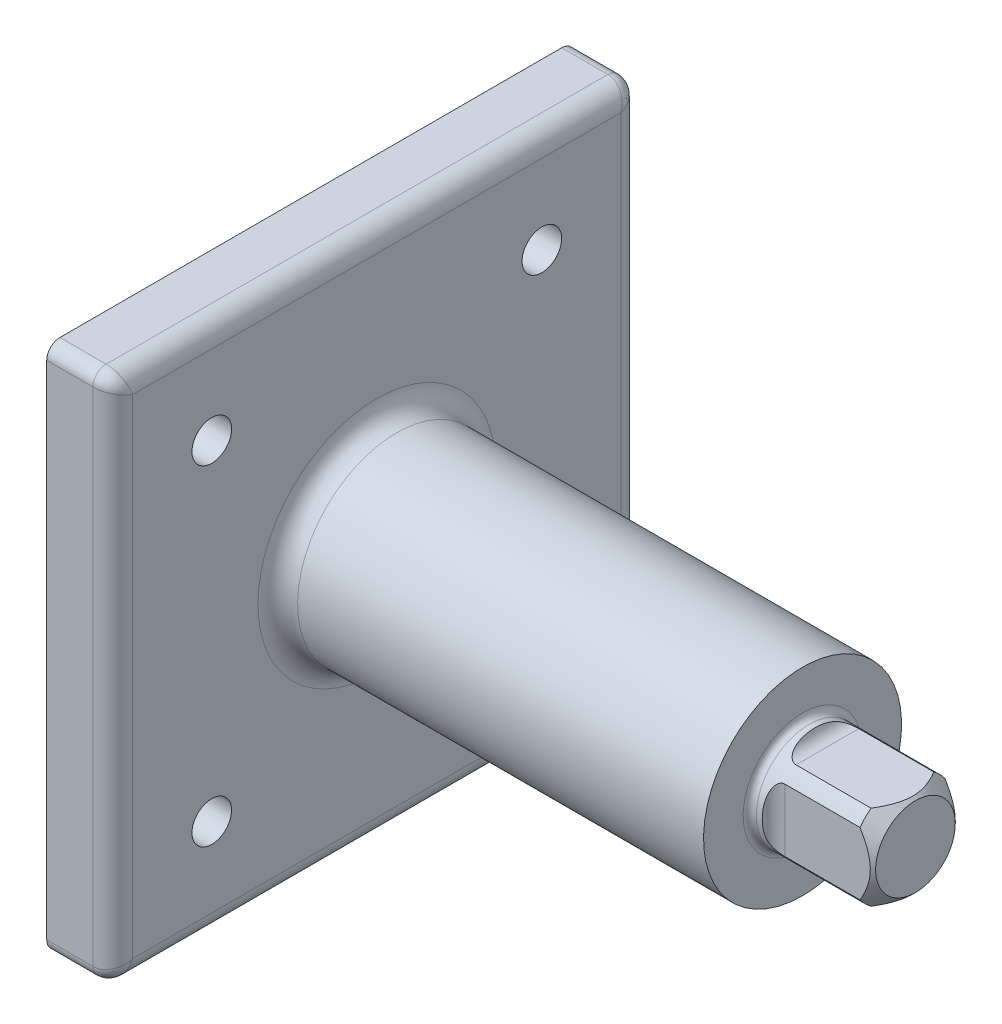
SolidWorks part; units mm, degrees
other "Markup1"
sketch "Sketch7"
ref_plane "Front Plane" through (0, 0, 0) normal (0, 0, 1) x (1, 0, 0)
ref_plane "Top Plane" through (0, 0, 0) normal (0, 1, 0) x (1, 0, 0)
ref_plane "Right Plane" through (0, 0, 0) normal (1, 0, 0) x (0, 0, -1)
sketch "Sketch1" plane through (0, 0, 0) normal (0, 0, 1) x (1, 0, 0)
  line L0 (-31.75, 0) -> (31.75, 0) construction
  line L1 (31.75, -6.35) -> (31.75, 6.35) construction
  point P4 (0, 0)
  point P8 (31.75, 0)
sketch "Sketch2" plane through (0, 0, 0) normal (0, 0, 1) x (1, 0, 0)
  line L3 (31.75, 8) -> (31.75, 0)
  line L4 (31.75, 0) -> (-41.67, 0)
  line L6 (14.65, 15) -> (14.65, 8)
  line L7 (-49.8414, 15) -> (14.65, 15)
  line L8 (31.75, 8) -> (14.65, 8)
  line L9 (-49.8414, 15) -> (-49.8414, 0)
  line L10 (-41.67, 0) -> (-49.8414, 0)
  dimension "D1" = 15
  dimension "D2" = 64.4914
  dimension "D3" = 17.1
  dimension "D4" = 8
revolve "Revolve1" add sketch "Sketch2" angle 360 about L0
sketch "Sketch3" plane through (31.75, 0, 0) normal (1, 0, 0) x (0, 0, -1)
  line L1 (-6.435, -6.435) -> (6.435, -6.435)
  line L2 (-6.435, -6.435) -> (-6.435, 6.435)
  line L3 (-6.435, 6.435) -> (6.435, 6.435)
  line L4 (6.435, -6.435) -> (6.435, 6.435)
  line L5 (-6.435, -6.435) -> (6.435, 6.435) construction
  line L6 (-6.435, 6.435) -> (6.435, -6.435) construction
  point P0 (0, 0)
  dimension "D1" = 12.87
extrude "Cut-Extrude1" cut sketch "Sketch3" against normal blind 15.24 flip side to cut
sketch "Sketch4" plane through (31.75, 0, 0) normal (1, 0, 0) x (0, 0, -1)
  circle A0 centre (0, 0) radius 6.0325
extrude "Cut-Extrude2" cut sketch "Sketch4" against normal through all draft 45 flip side to cut
fillet "Fillet1" radius 1.905 4 edges at (16.51, 0, -6.435) (16.51, -6.435, 0) (16.51, 0, 6.435) (16.51, 6.435, 0)
sketch "Sketch5" plane through (-49.8414, 0, 0) normal (-1, 0, 0) x (0, 0, 1)
  line L1 (-40, 40) -> (40, 40)
  line L2 (-40, 40) -> (-40, -40)
  line L3 (-40, -40) -> (40, -40)
  line L4 (40, 40) -> (40, -40)
  line L5 (-40, 40) -> (40, -40) construction
  line L6 (-40, -40) -> (40, 40) construction
  point P0 (0, 0)
  dimension "D1" = 80
  dimension "D2" = 80
extrude "Boss-Extrude1" add sketch "Sketch5" along normal blind 10
sketch "Sketch6" plane through (-49.8414, 0, 0) normal (1, 0, 0) x (0, 0, -1)
  line L0 (0, 45.8175) -> (0, -47.1215) construction
  line L1 (-48.8805, 25) -> (80.4411, 25) construction
  line L2 (-60.4071, 0) -> (88.1375, 0) construction
  line L3 (-40, 40) -> (40, 40) construction
  line L4 (-25, 43.5402) -> (-25, -52.1039) construction
  line L5 (-40, -40) -> (-40, 40) construction
  circle A0 centre (-25, 25) radius 3
  circle A1 centre (25, 25) radius 3
  circle A2 centre (25, -25) radius 3
  circle A3 centre (-25, -25) radius 3
  dimension "D3" = 6
  dimension "D1" = 15
  dimension "D2" = 15
extrude "Cut-Extrude3" cut sketch "Sketch6" against normal through all both and the other way through all
fillet "Fillet2" radius 3 5 edges at (-49.8414, -40, 0) (-49.8414, 0, 40) (-49.8414, -15, 0) (-49.8414, 40, 0) (-49.8414, 0, -40)
fillet "Fillet3" radius 2 8 edges at (-50.7201, 39.1213, 39.1213) (-50.7201, -39.1213, 39.1213) (-50.7201, -39.1213, -39.1213) (-50.7201, 39.1213, -39.1213) (-56.3414, 40, 40) (-56.3414, -40, 40) (-56.3414, -40, -40) (-56.3414, 40, -40)
fillet "Fillet4" radius 1 1 edges at (14.65, -8, 0)
equation "\"D1\"= \"D1@Cut-Extrude1\""
equation "\"D1\"= \"Square Drive Size@Sketch1\" * .05"
equation "\"D1@Fillet1\"=\"Square Drive Size@Sketch1\"*.15"
equation "\"D1@Sketch4\"=\"Square Drive Size@Sketch1\"*.95"
